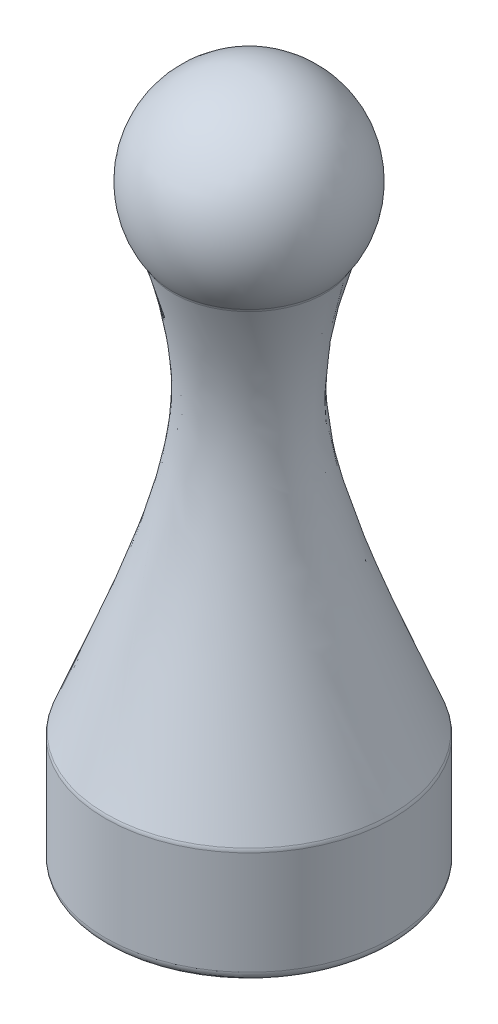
SolidWorks part; units mm, degrees
ref_plane "Front Plane" through (0, 0, 0) normal (0, 0, 1) x (1, 0, 0)
ref_plane "Top Plane" through (0, 0, 0) normal (0, 1, 0) x (1, 0, 0)
ref_plane "Right Plane" through (0, 0, 0) normal (1, 0, 0) x (0, 0, -1)
sketch "Sketch1" plane through (0, 0, 0) normal (0, 1, 0) x (1, 0, 0)
  circle A0 centre (0, 0) radius 15
extrude "Boss-Extrude1" add sketch "Sketch1" along normal blind 10
sketch "Sketch2" plane through (0, 10, 0) normal (0, 1, 0) x (1, 0, 0)
  circle A0 centre (0, 0) radius 15
ref_plane "Plane1" through (0, 60, 0) normal (0, 1, 0) x (1, 0, 0)
sketch "Sketch3" plane through (0, 60, 0) normal (0, 1, 0) x (1, 0, 0)
  circle A0 centre (0, 0) radius 10
loft "Loft1" add profiles "Sketch3", "Sketch2"
sketch "Sketch4" plane through (0, 60, 0) normal (0, 1, 0) x (1, 0, 0)
  line L0 (0, 10) -> (0, -10)
  circle A0 centre (0, 0) radius 10 construction
  arc A1 (0, 10) -> (0, -10) centre (0, 0) cw
revolve "Revolve1" add sketch "Sketch4" angle 360 about L0
sketch "Sketch5" plane through (0, 0, 0) normal (0, -1, 0) x (1, 0, 0)
  line L37 (-18.2205, 8.8545) -> (-18.2205, -10.9402) construction
  line L38 (-1.4814, -1.8316) -> (-1.6632, -2.935) construction
  line L39 (-1.0151, 0.9979) -> (-1.3587, -1.0871) construction
  line L40 (0.0081, -1.7512) -> (-6.9181, -0.61) construction
  line L41 (0.559, 0) -> (-1.6166, 0.3585) construction
  line L42 (-1.687, -0.0688) -> (-1.8416, -1.0075)
  line L43 (-0.7211, -0.228) -> (-0.8757, -1.1667)
  line L44 (-1.5462, 0.7858) -> (-2.3697, 0.9215)
  line L45 (-1.687, -0.0688) -> (-2.4266, 0.053)
  line L46 (-1.8416, -1.0075) -> (-2.7822, -0.8525)
  line L47 (-3.4129, -0.7486) -> (-6.8477, -0.1827)
  line L48 (-3.0198, 0.1508) -> (-4.572, 0.4065)
  line L49 (-2.9824, 1.0224) -> (-4.6964, 1.3049)
  line L50 (-5.3138, 1.4066) -> (-6.2967, 1.5686)
  line L51 (-5.1876, 0.508) -> (-6.4376, 0.7139)
  line L52 (-5.249, -1.3239) -> (-6.9885, -1.0373)
  line L53 (-3.8876, -1.5482) -> (-4.6564, -1.4216)
  line L54 (-1.9825, -1.8622) -> (-3.2563, -1.6523)
  line L55 (-1.9825, -1.8622) -> (-2.1461, -2.8555)
  line L56 (4.2263, -2.2789) -> (1.9214, -4.0838)
  line L57 (3.8607, -1.3299) -> (1.3217, -3.3181)
  line L58 (4.8771, -1.7693) -> (5.4141, -3.1636)
  line L59 (4.2263, -2.2789) -> (4.6764, -3.4477)
  line L60 (-0.5322, 0.9184) -> (-0.5802, 0.6266)
  line L61 (-1.4981, 1.0775) -> (-1.5462, 0.7858)
  line L62 (8.6507, 1.1857) -> (4.8771, -1.7693)
  line L63 (8.0511, 1.9514) -> (4.5116, -0.8202)
  line L64 (3.8545, 0.8859) -> (4.5116, -0.8202)
  line L65 (3.171, 2.6607) -> (3.5292, 1.7306)
  line L66 (2.4333, 2.3765) -> (3.8607, -1.3299)
  line L67 (-1.0165, -2.0213) -> (-1.1802, -3.0146)
  line L68 (-0.0624, -2.1785) -> (-1.0165, -2.0213)
  line L69 (0.0785, -1.3239) -> (-0.8757, -1.1667)
  line L70 (0.4886, -0.4273) -> (-0.7211, -0.228)
  line L71 (0.6294, 0.4273) -> (-0.5802, 0.6266)
  line L72 (6.2652, -6.1784) -> (-7.205, -4.0838) construction
  line L73 (6.3333, -5.7403) -> (-7.1368, -3.6456)
  line L74 (6.1971, -6.6166) -> (-7.2731, -4.522)
  circle A0 centre (0, 0) radius 15
  circle A1 centre (0, 0) radius 13
  arc A23 (3.4796, 0.7595) -> (3.4054, 0.743) centre (2.9686, 2.8935) cw
  arc A24 (-7.205, -1.9798) -> (-7.6544, -2.3773) centre (-7.4297, -2.1785) ccw
  arc A25 (-1.1802, -3.0146) -> (-1.7234, -3.4208) centre (-1.6632, -2.935) cw
  arc A26 (-1.4981, 1.0775) -> (-0.5322, 0.9184) centre (-1.0151, 0.9979) cw
  circle A27 centre (-0.6609, 2.5186) radius 0.8053
  circle A28 centre (6.2652, 2.1806) radius 0.6408
  arc A29 (4.2338, 3.1505) -> (5.119, 3.3304) centre (4.6764, 3.2404) cw
  arc A30 (4.2338, 3.1505) -> (3.5292, 1.7306) centre (2.9686, 2.8935) cw
  arc A31 (5.119, 3.3304) -> (3.8545, 0.8859) centre (2.9686, 2.8935) cw
  arc A32 (-2.1513, -2.9712) -> (-2.1461, -2.8555) centre (-1.6632, -2.935) cw
  arc A33 (1.9214, -4.0838) -> (1.3217, -3.3181) centre (1.6215, -3.7009) cw
  arc A34 (8.0511, 1.9514) -> (8.6507, 1.1857) centre (8.3509, 1.5686) cw
  arc A35 (5.4141, -3.1636) -> (4.6764, -3.4477) centre (5.0453, -3.3057) cw
  arc A36 (2.4333, 2.3765) -> (3.171, 2.6607) centre (2.8021, 2.5186) cw
  arc A37 (-6.9885, -1.0373) -> (-6.8477, -0.1827) centre (-6.9181, -0.61) cw
  arc A38 (0.0785, -1.3239) -> (-0.0624, -2.1785) centre (0.0081, -1.7512) cw
  arc A39 (-6.4376, 0.7139) -> (-6.2967, 1.5686) centre (-6.3672, 1.1412) cw
  arc A40 (0.6294, 0.4273) -> (0.4886, -0.4273) centre (0.559, 0) cw
  arc A41 (6.3333, -5.7403) -> (6.1971, -6.6166) centre (6.2652, -6.1784) cw
  arc A42 (-7.2731, -4.522) -> (-7.1368, -3.6456) centre (-7.205, -4.0838) cw
  spline S10 degree 3 poles (-4.572, 0.4065) (-4.5418, 0.1224) (-4.5235, -0.2007) (-4.5398, -0.5414) (-4.541, -0.5627) knots 0.703072 0.703072 0.703072 0.703072 0.75 0.753128 0.753128 0.753128 0.753128
  spline S11 degree 3 poles (-5.1876, 0.508) (-5.1473, 0.1937) (-5.1226, -0.1223) (-5.137, -0.4645) knots 0.693045 0.693045 0.693045 0.693045 0.749636 0.749636 0.749636 0.749636
  spline S12 degree 3 poles (-5.249, -1.3239) (-5.2712, -1.4241) (-5.344, -1.7073) (-5.5048, -2.1232) (-5.7475, -2.4823) (-5.9968, -2.6517) (-6.2439, -2.6835) (-6.5801, -2.5496) (-6.9122, -2.2893) (-7.1154, -2.081) (-7.205, -1.9798) knots 0.795978 0.795978 0.795978 0.795978 0.8125 0.84375 0.875 0.90625 0.9375 0.96875 0.984375 1 1 1 1
  spline S13 degree 3 poles (-4.6564, -1.4216) (-4.6832, -1.5458) (-4.8219, -2.0931) (-5.1308, -2.7652) (-5.7536, -3.2366) (-6.3756, -3.2997) (-6.9009, -3.0627) (-7.3201, -2.7312) (-7.5505, -2.4948) (-7.6544, -2.3773) knots 0.794442 0.794442 0.794442 0.794442 0.8125 0.875 0.90625 0.9375 0.96875 0.984375 1 1 1 1
  spline S14 degree 3 poles (-2.7822, -0.8525) (-2.7312, -0.7591) (-2.5816, -0.4669) (-2.4756, -0.1622) (-2.4285, 0.0446) (-2.4266, 0.053) knots 0.266365 0.266365 0.266365 0.266365 0.28125 0.3125 0.313824 0.313824 0.313824 0.313824
  spline S15 degree 3 poles (-2.1513, -2.9712) (-2.1596, -2.9744) (-2.2883, -3.0212) (-2.6407, -3.0745) (-3.1936, -2.9648) (-3.5732, -2.7189) (-3.628, -2.5769) (-3.5695, -2.219) (-3.3827, -1.8677) (-3.2677, -1.6715) (-3.2563, -1.6523) knots 0.029037 0.029037 0.029037 0.029037 0.03125 0.0625 0.09375 0.125 0.15625 0.1875 0.21875 0.222132 0.222132 0.222132 0.222132
  spline S16 degree 3 poles (-3.4129, -0.7486) (-3.3265, -0.6008) (-3.154, -0.2853) (-3.0562, -0.0016) (-3.0198, 0.1508) knots 0.255756 0.255756 0.255756 0.255756 0.28125 0.311624 0.311624 0.311624 0.311624
  spline S17 degree 3 poles (-1.7234, -3.4208) (-1.8003, -3.4714) (-2.0986, -3.6155) (-2.6756, -3.6809) (-3.3866, -3.535) (-3.9982, -3.2145) (-4.2838, -2.5663) (-4.1292, -2.0212) (-3.9652, -1.6899) (-3.8876, -1.5482) knots 0.019454 0.019454 0.019454 0.019454 0.03125 0.0625 0.09375 0.125 0.15625 0.1875 0.211021 0.211021 0.211021 0.211021
  spline S18 degree 3 poles (-2.3697, 0.9215) (-2.3773, 1.0175) (-2.4366, 1.5083) (-2.6514, 2.2135) (-3.0718, 3.0301) (-3.5158, 3.4237) (-4.0277, 3.4737) (-4.4907, 3.345) (-5.0096, 2.9948) (-5.3641, 2.3174) (-5.3518, 1.7802) (-5.3242, 1.4965) (-5.3138, 1.4066) knots 0.359769 0.359769 0.359769 0.359769 0.375 0.4375 0.46875 0.5 0.515625 0.53125 0.5625 0.59375 0.625 0.640108 0.640108 0.640108 0.640108
  spline S19 degree 3 poles (-2.9824, 1.0224) (-2.9864, 1.0522) (-3.0159, 1.2456) (-3.1078, 1.6174) (-3.3096, 2.1924) (-3.5804, 2.6852) (-3.8015, 2.8478) (-3.9544, 2.863) (-4.2091, 2.8052) (-4.5645, 2.5521) (-4.7479, 2.2061) (-4.7534, 1.7643) (-4.716, 1.4475) (-4.6964, 1.3049) knots 0.369281 0.369281 0.369281 0.369281 0.375 0.40625 0.4375 0.46875 0.5 0.515625 0.53125 0.5625 0.59375 0.625 0.650567 0.650567 0.650567 0.650567
  text T0 "<b>.</b>" font "Engravers MT" height 2.4
  point P239 (-0.4699, -5.1311)
  point P244 (-1.3392, -0.9685)
  point P245 (4.4215, 1.9312)
  point P246 (4.9862, -1.0662)
  point P247 (3.9237, -0.3935)
  point P248 (-3.455, -1.1806)
  point P249 (-2.9041, 0.5706)
  dimension "D1" = 2
extrude "Boss-Extrude2" add sketch "Sketch5" along normal blind 2
sketch "Sketch6" plane through (0, 0, 0) normal (0, -1, 0) x (1, 0, 0)
  text T0 "<b>ENGR. IMAAD ULLAH KHAN YAMEEN</b>"
extrude "Boss-Extrude3" add sketch "Sketch6" along normal blind 2
fillet "Fillet1" radius 1 3 edges at (0, 53.9588, -7.969) (0, 10, 15) (0, -2, -15)
